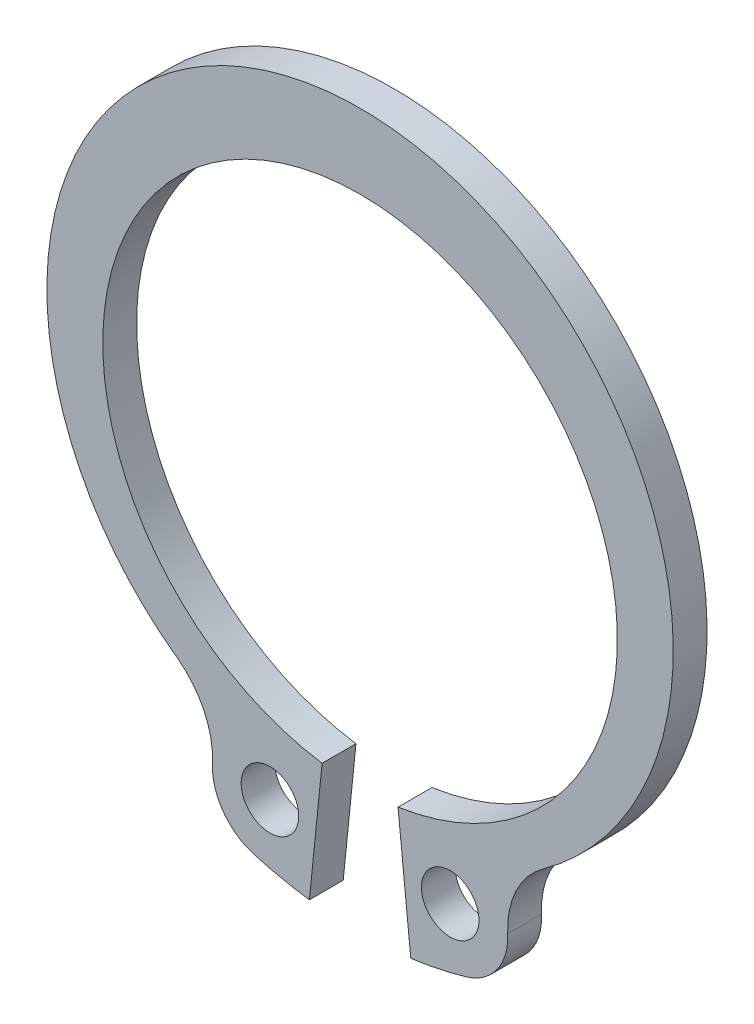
SolidWorks part; units mm, degrees
ref_plane "Face" through (0, 0, 0) normal (0, 0, 1) x (1, 0, 0)
ref_plane "Dessus" through (0, 0, 0) normal (0, 1, 0) x (1, 0, 0)
ref_plane "Droite" through (0, 0, 0) normal (1, 0, 0) x (0, 0, -1)
sketch "Esquisse1" plane through (0, 0, 0) normal (0, 0, 1) x (1, 0, 0)
  line L0 (0, 9.8) -> (0, 7.6) construction
  line L1 (1.1214, -7.5168) -> (1.4975, -11.1976)
  line L2 (-1.1214, -7.5168) -> (-1.4975, -11.1976)
  line L3 (0.34, -7.3421) -> (0.34, -11.0421) construction
  line L4 (-0.34, -7.3421) -> (-0.34, -11.0421) construction
  arc A0 (1.1214, -7.5168) -> (-1.1214, -7.5168) centre (0, 0) ccw
  arc A1 (5.4149, -6.9494) -> (-5.4149, -6.9494) centre (0, 0.55) ccw
  arc A2 (1.4975, -11.1976) -> (3.1342, -10.8539) centre (0, 0) ccw
  circle A3 centre (2.6626, -9.2206) radius 0.85
  arc A4 (3.1342, -10.8539) -> (4.3606, -9.1391) centre (2.6626, -9.2206) ccw
  arc A5 (5.4149, -6.9494) -> (4.3606, -9.1391) centre (6.9077, -9.0168) ccw
  circle A6 centre (-2.6626, -9.2206) radius 0.85
  arc A7 (-5.4149, -6.9494) -> (-4.3606, -9.1391) centre (-6.9077, -9.0168) cw
  arc A8 (-3.1342, -10.8539) -> (-4.3606, -9.1391) centre (-2.6626, -9.2206) cw
  arc A9 (-1.4975, -11.1976) -> (-3.1342, -10.8539) centre (0, 0) cw
  arc A10 (0.34, -7.3421) -> (-0.34, -7.3421) centre (0, 0) ccw construction
  circle A11 centre (0, 0) radius 8 construction
extrude "Base-Extrusion" add sketch "Esquisse1" along normal blind 1
equation "\"D3@Esquisse1\" = \"b@Esquisse1\"/4"
equation "\"D7@Esquisse1\"=\"dtrou@Esquisse1\"*0.8"
equation "\"D8@Esquisse1\" = \"dtrou@Esquisse1\""
equation "\"D9@Esquisse1\" = \"dtrou@Esquisse1\"*1.5"
equation "\"D12@Esquisse1\" = \"dtrou@Esquisse1\"*0.4"
equation "\"D5@Esquisse1\" = 360-(360-\"D13@Esquisse1\")*\"dint@Esquisse1\"/\"dgorge@Esquisse1\""
equation "\"D14@Esquisse1\" = (\"D5@Esquisse1\"-\"D13@Esquisse1\")/2"
